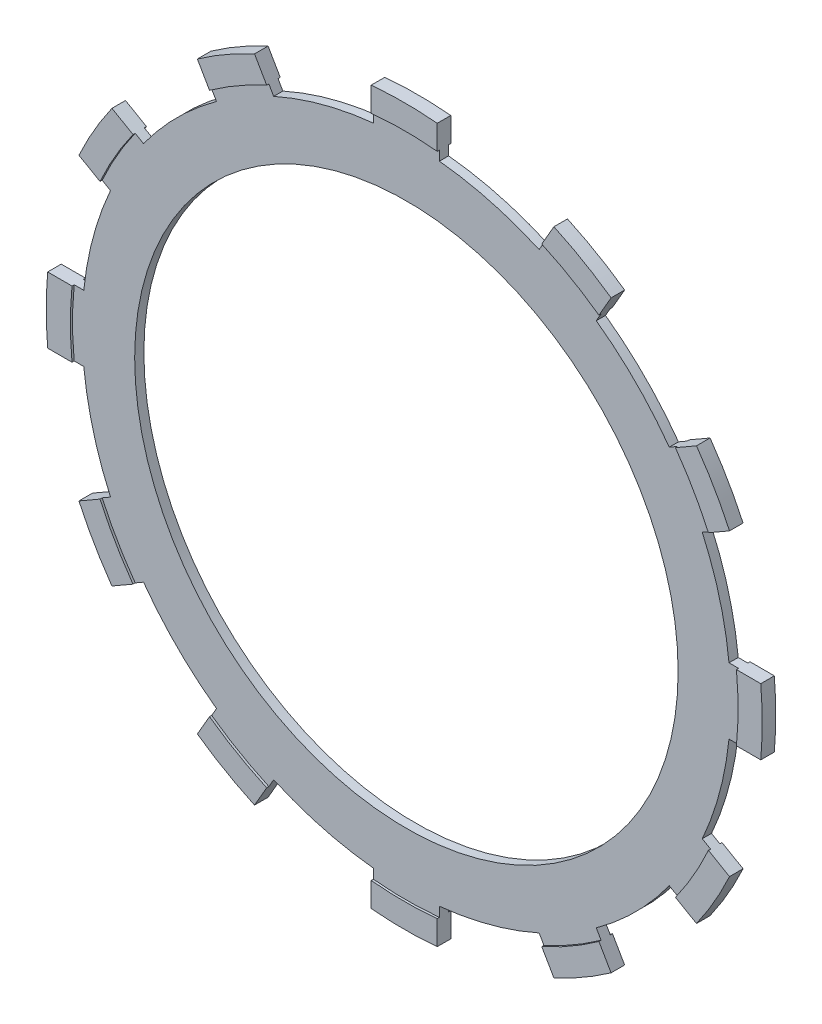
SolidWorks part; units mm, degrees
other "詳細ｱｲﾃﾑ1"
ref_plane "正面" through (0, 0, 0) normal (0, 0, 1) x (1, 0, 0)
ref_plane "平面" through (0, 0, 0) normal (0, 1, 0) x (1, 0, 0)
ref_plane "右側面" through (0, 0, 0) normal (1, 0, 0) x (0, 0, -1)
sketch "ｽｹｯﾁ1" plane through (0, 0, 0) normal (0, 0, 1) x (1, 0, 0)
  circle A0 centre (0, 0) radius 66.95
  circle A1 centre (0, 0) radius 56.1
  dimension "D1" = 112.2
  dimension "D2" = 133.9
extrude "ﾎﾞｽ - 押し出し1" add sketch "ｽｹｯﾁ1" along normal blind 1.9
sketch "ｽｹｯﾁ2" plane through (0, 0, 0) normal (0, 0, 1) x (1, 0, 0)
  line L0 (-6.815, 66.6022) -> (-6.815, 73.6102)
  line L1 (0, 0) -> (0, 75.7962) construction
  line L2 (6.815, 66.6022) -> (6.815, 73.6102)
  arc A0 (6.815, 66.6022) -> (-6.815, 66.6022) centre (0, 0) ccw
  circle A1 centre (0, 0) radius 66.95 construction
  arc A2 (-6.815, 73.6102) -> (6.815, 73.6102) centre (0, 0) cw
  dimension "D2" = 73.925
  dimension "D1" = 13.63
extrude "ﾎﾞｽ - 押し出し2" add sketch "ｽｹｯﾁ2" along normal up to surface (1.9 mm away)
sketch "ｽｹｯﾁ3" plane through (0, 0, 1.9) normal (0, 0, 1) x (1, 0, 0)
  line L0 (-6.815, 73.6102) -> (-6.815, 68.5873)
  line L1 (-6.815, 73.6102) -> (-6.815, 66.6022) construction
  line L2 (6.815, 73.6102) -> (6.815, 68.5873)
  line L3 (6.815, 66.6022) -> (6.815, 73.6102) construction
  arc A0 (-6.815, 73.6102) -> (6.815, 73.6102) centre (0, 0) cw
  arc A1 (6.815, 73.6102) -> (-6.815, 73.6102) centre (0, 0) ccw construction
  arc A2 (6.815, 68.5873) -> (-6.815, 68.5873) centre (0, 0) ccw
  arc A3 (-6.815, 66.6022) -> (6.815, 66.6022) centre (0, 0) ccw construction
  dimension "D1" = 5
extrude "ﾎﾞｽ - 押し出し3" add sketch "ｽｹｯﾁ3" along normal blind 0.45 and the other way offset from surface (2.35 mm away) 0.45
pattern_circular "円形ﾊﾟﾀｰﾝ1" count 12 over 360 about axis through (0, 0, 0) along (0, 0, 1) of "ﾎﾞｽ - 押し出し3", "ﾎﾞｽ - 押し出し2"
